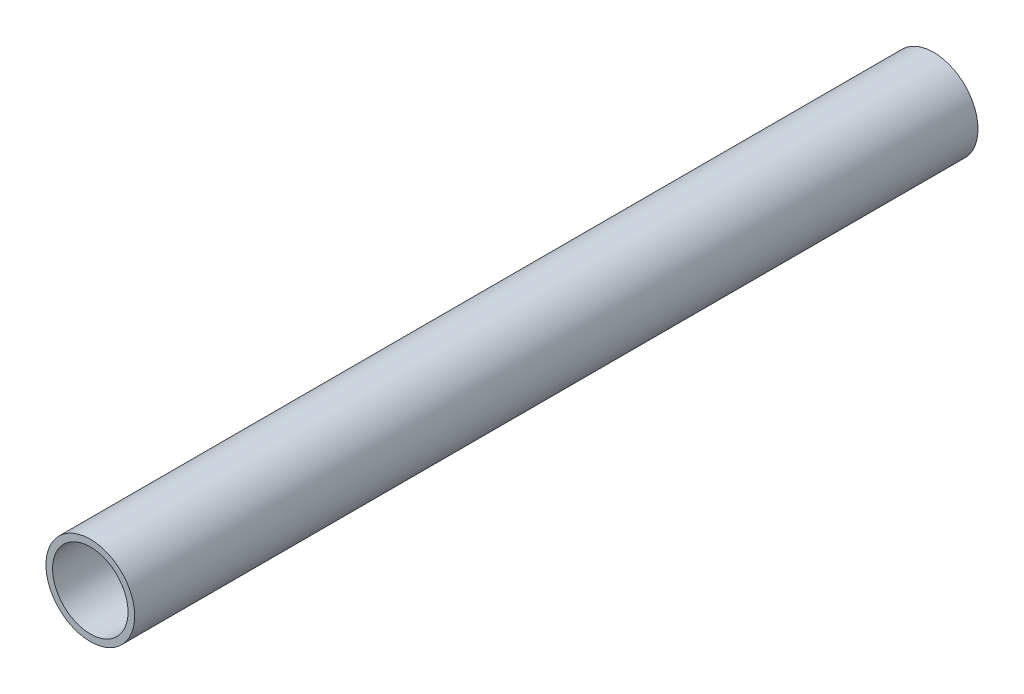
SolidWorks part; units mm, degrees
ref_plane "前视基准面" through (0, 0, 0) normal (0, 0, 1) x (1, 0, 0)
ref_plane "上视基准面" through (0, 0, 0) normal (0, 1, 0) x (1, 0, 0)
ref_plane "右视基准面" through (0, 0, 0) normal (1, 0, 0) x (0, 0, -1)
sketch "草图1" plane through (0, 0, 0) normal (0, 0, 1) x (1, 0, 0)
  circle A0 centre (0, 0) radius 20
  circle A1 centre (0, 0) radius 17
extrude "凸台-拉伸1" add sketch "草图1" along normal blind 380
